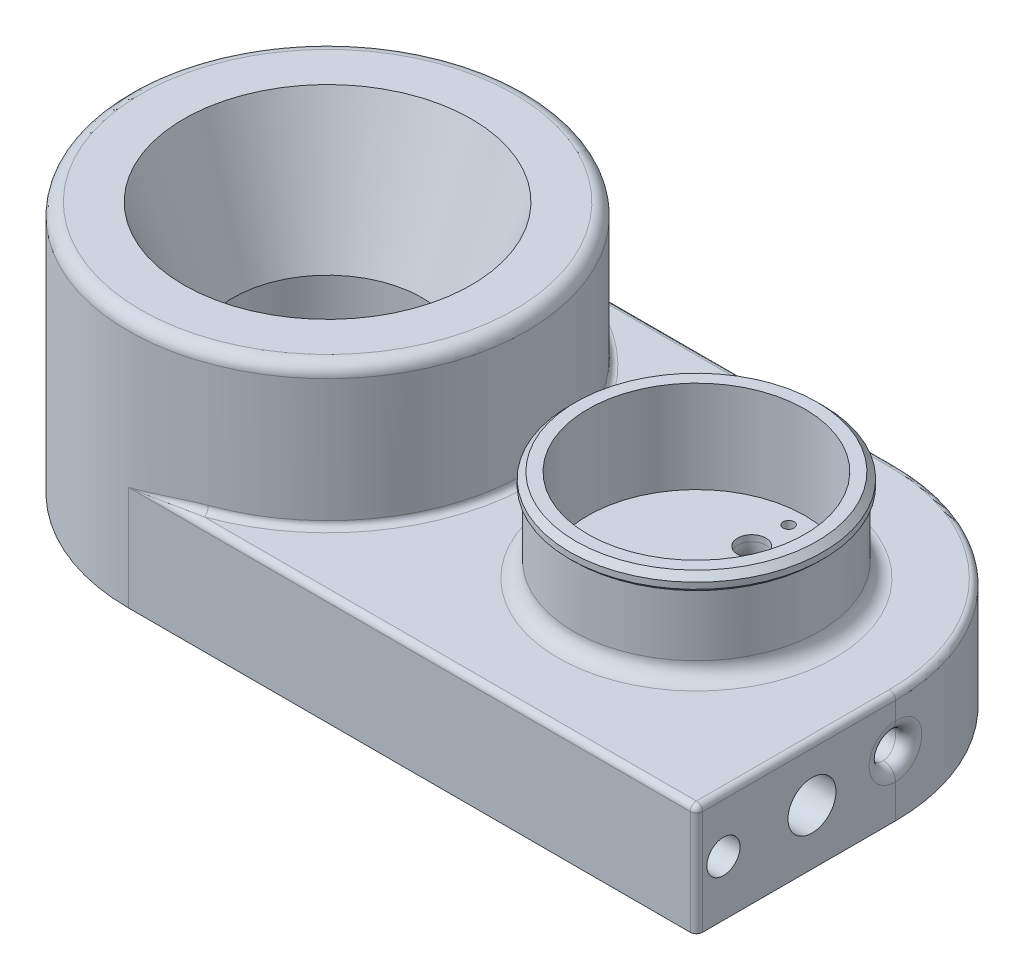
SolidWorks part; units mm, degrees
ref_plane "Front Plane" through (0, 0, 0) normal (0, 0, 1) x (1, 0, 0)
ref_plane "Top Plane" through (0, 0, 0) normal (0, 1, 0) x (1, 0, 0)
ref_plane "Right Plane" through (0, 0, 0) normal (1, 0, 0) x (0, 0, -1)
other "Join1"
other "Pump Base Rev A<1>@P-201660-14"
other "Squirty funnel<1>@P-201660-14"
fillet "Fillet1" radius 1.27 6 edges at (105.296, 35.56, -29.096) (38.1, 35.56, -41.148) (41.148, 35.56, 0) (117.348, 35.56, 19.939) (58.039, 35.56, 41.148) (116.976, 35.56, 40.776)
chamfer "Chamfer1" distance 1.27 angle 45 2 edges at (76.2, 50.8, 26.1874) (76.2, 54.61, 26.1874)
ref_plane "Plane12" through (38.1, 0, 0) normal (1, 0, 0) x (0, 0, -1)
